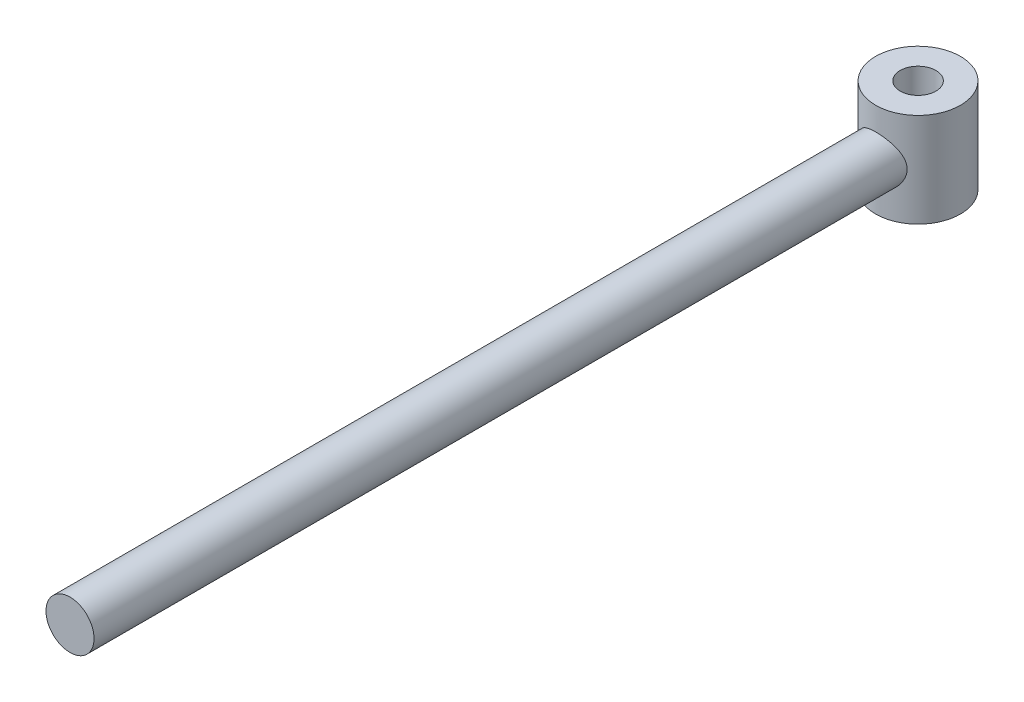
SolidWorks part; units mm, degrees
ref_plane "Front Plane" through (0, 0, 0) normal (0, 0, 1) x (1, 0, 0)
ref_plane "Top Plane" through (0, 0, 0) normal (0, 1, 0) x (1, 0, 0)
ref_plane "Right Plane" through (0, 0, 0) normal (1, 0, 0) x (0, 0, -1)
sketch "Sketch1" plane through (0, 0, 0) normal (0, 0, 1) x (1, 0, 0)
  circle A0 centre (0, 0) radius 51
  dimension "D1" = 102
extrude "Boss-Extrude1" add sketch "Sketch1" along normal mid plane 1800
sketch "Sketch2" plane through (0, 0, 0) normal (0, 1, 0) x (1, 0, 0)
  line L0 (51, 900) -> (-51, 900) construction
  circle A0 centre (0, 900) radius 90
  dimension "D1" = 180
extrude "Boss-Extrude2" add sketch "Sketch2" along normal mid plane 200
sketch "Sketch3" plane through (0, 100, 0) normal (0, 1, 0) x (1, 0, 0)
  circle A0 centre (0, 900) radius 38
  dimension "D1" = 76
extrude "Cut-Extrude1" cut sketch "Sketch3" against normal through all both and the other way through all
